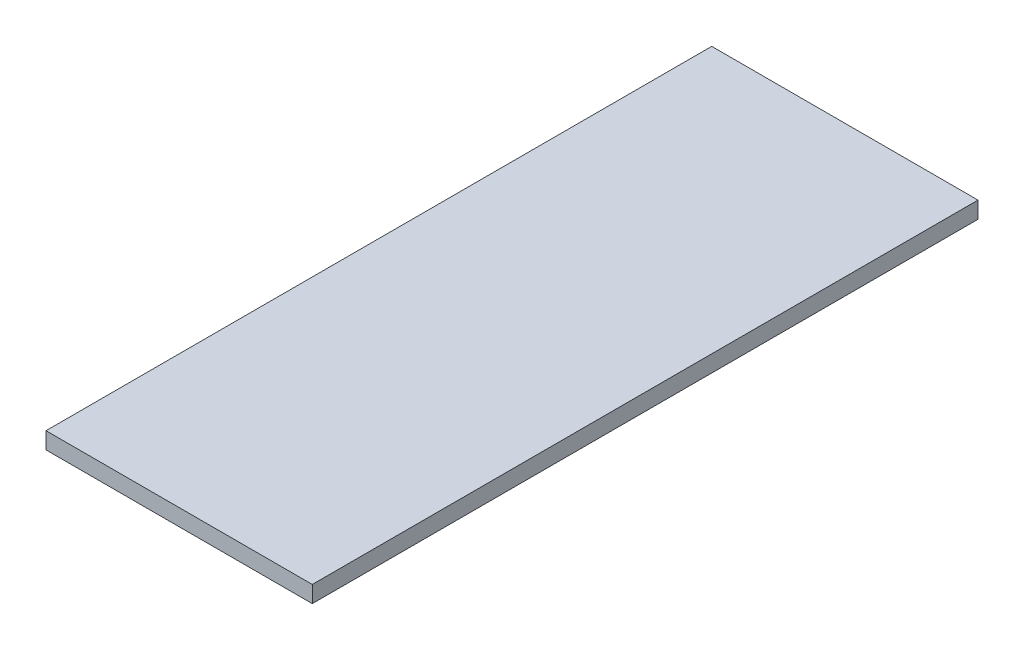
SolidWorks part; units mm, degrees
ref_plane "Face" through (0, 0, 0) normal (0, 0, 1) x (1, 0, 0)
ref_plane "Dessus" through (0, 0, 0) normal (0, 1, 0) x (1, 0, 0)
ref_plane "Droite" through (0, 0, 0) normal (1, 0, 0) x (0, 0, -1)
sketch "Esquisse1" plane through (0, 0, 0) normal (0, 0, 1) x (1, 0, 0)
  line L1 (0, 0) -> (80, 0)
  line L2 (0, 0) -> (0, -5)
  line L3 (0, -5) -> (80, -5)
  line L4 (80, 0) -> (80, -5)
  dimension "D1" = 80
  dimension "D2" = 5
extrude "Base-Extrusion" add sketch "Esquisse1" along normal blind 200
